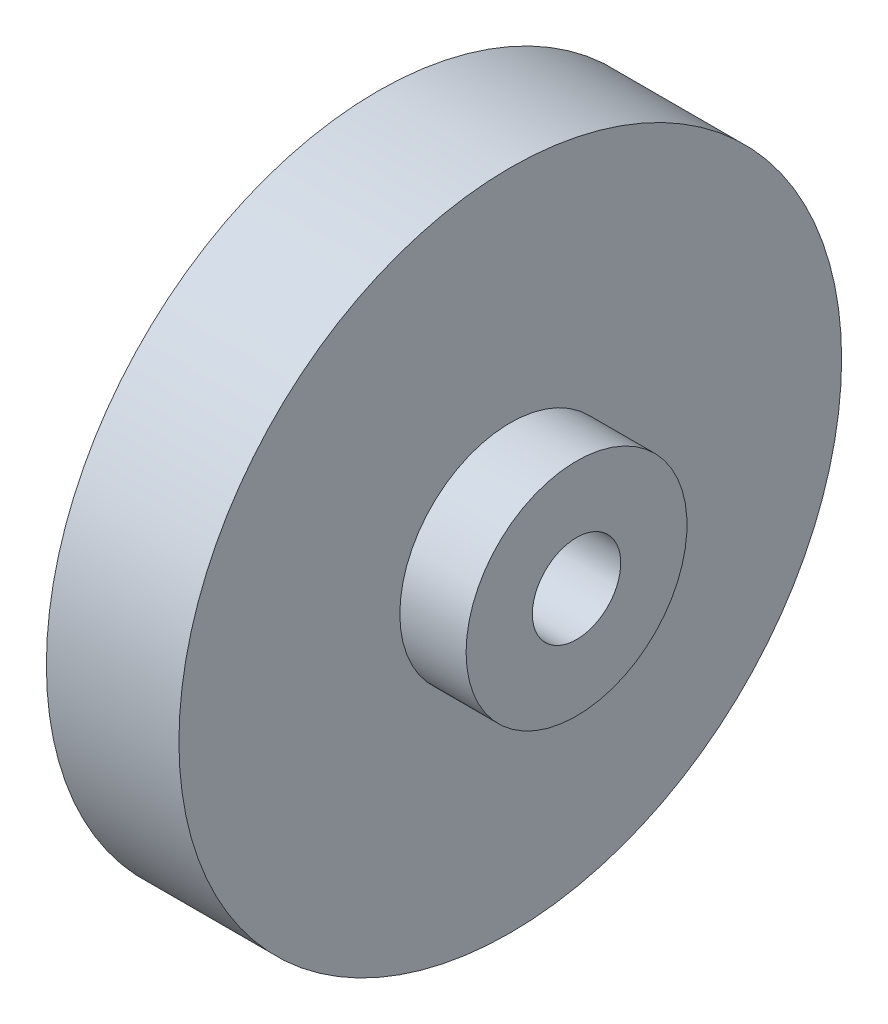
SolidWorks part; units mm, degrees
ref_plane "Front" through (0, 0, 0) normal (0, 0, 1) x (1, 0, 0)
ref_plane "Top" through (0, 0, 0) normal (0, 1, 0) x (1, 0, 0)
ref_plane "Right" through (0, 0, 0) normal (1, 0, 0) x (0, 0, -1)
sketch "Sketch1" plane through (0, 0, 0) normal (0, 0, 1) x (1, 0, 0)
  line L0 (0, 0) -> (12, 0)
  line L1 (12, 2) -> (12, 5)
  line L2 (12, 5) -> (9, 5)
  line L3 (9, 5) -> (9, 15)
  line L4 (9, 15) -> (3, 15)
  line L5 (3, 15) -> (3, 5)
  line L6 (3, 5) -> (0, 5)
  line L7 (0, 5) -> (0, 2)
  line L8 (0, 2) -> (12, 2)
revolve "Revolve1" add sketch "Sketch1" angle 360 about L0
